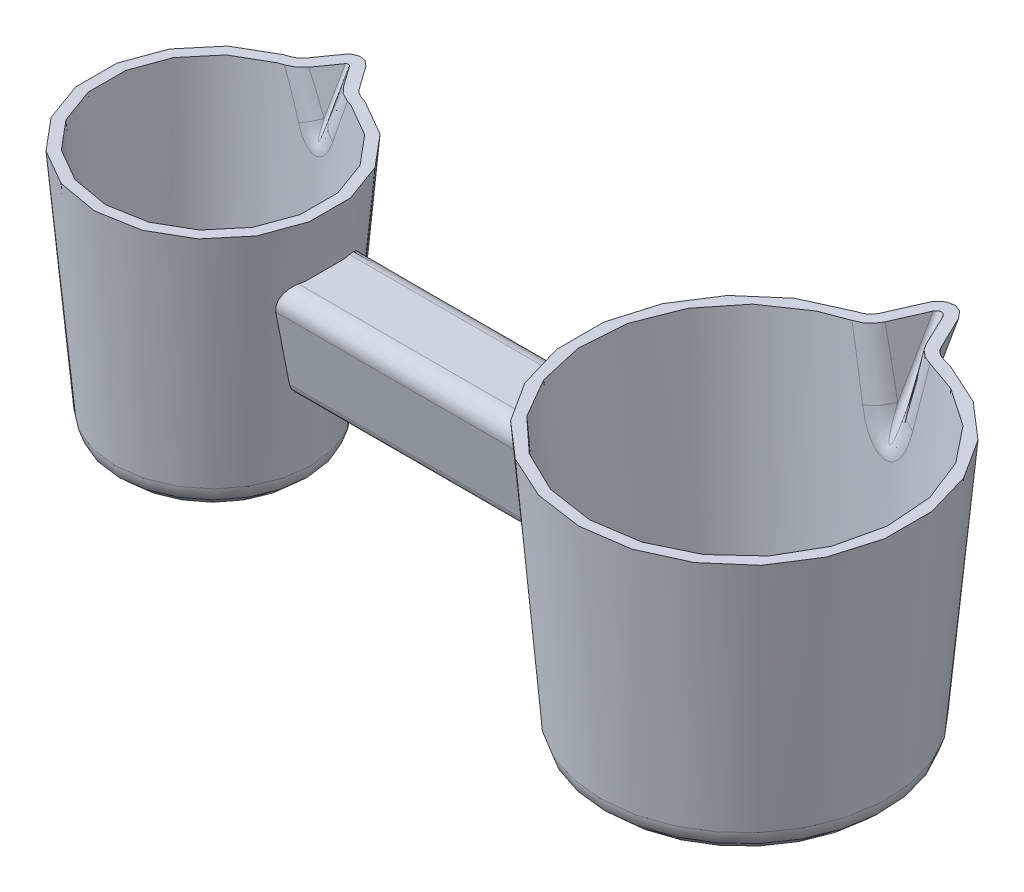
SolidWorks part; units mm, degrees
ref_plane "Front" through (0, 0, 0) normal (0, 0, 1) x (1, 0, 0)
ref_plane "Top" through (0, 0, 0) normal (0, 1, 0) x (1, 0, 0)
ref_plane "Right" through (0, 0, 0) normal (1, 0, 0) x (0, 0, -1)
sketch "Sketch2" plane through (0, 0, 0) normal (0, 1, 0) x (1, 0, 0)
  circle A0 centre (-60.7304, 0) radius 17.7145
extrude "Extrude1" add sketch "Sketch2" along normal blind 47 draft 5
sketch "Sketch3" plane through (0, 0, 0) normal (0, 1, 0) x (1, 0, 0)
  circle A0 centre (37.0756, 0) radius 26.1266
extrude "Extrude2" add sketch "Sketch3" along normal blind 50 draft 5
fillet "Fillet1" radius 5 1 edges at (-60.7304, 0, 17.7145)
fillet "Fillet2" radius 5 1 edges at (37.0756, 0, 26.1266)
sketch "Sketch5" plane through (0, 50, 0) normal (0, 1, 0) x (-1, 0, 0)
  line L0 (-37.0756, 0) -> (60.7304, 0) construction
ref_plane "Plane1" through (0, 37.5, -21.6506) normal (0, 0.866, -0.5) x (-1, 0, 0)
sketch "Sketch6" plane through (0, 37.5, -21.6506) normal (0, 0.866, -0.5) x (-1, 0, 0)
  line L0 (-47.3646, 7.653) -> (-36.2106, -12.4863)
  line L1 (-36.2106, -12.4863) -> (-25.986, 7.653)
  line L2 (-47.3646, 7.653) -> (-25.986, 7.653)
  line L3 (-36.2106, -12.4863) -> (-36.6753, 7.653) construction
extrude "Extrude5" add sketch "Sketch6" along normal up to surface and the other way up to surface
fillet "Fillet5" radius 3 3 edges at (36.2106, 36.9375, -35.7438)
sketch "Sketch8" plane through (0, 37.5, -21.6506) normal (0, 0.866, -0.5) x (-1, 0, 0)
  line L0 (51.1463, 10.1442) -> (60.7304, -1.5655)
  line L1 (60.7304, -1.5655) -> (70.3145, 10.1442)
  line L2 (51.1463, 10.1442) -> (70.3145, 10.1442)
  line L3 (60.7304, -1.5655) -> (60.7304, 10.1442) construction
extrude "Extrude6" add sketch "Sketch8" along normal up to surface and the other way up to surface
fillet "Fillet6" radius 2.5 3 edges at (-60.7304, 39.7361, -24.7493)
sketch "Sketch4" plane through (0, 0, 0) normal (1, 0, 0) x (0, 0, -1)
  line L0 (0, 21.5542) -> (0, 37.0006) construction
  line L1 (0, 27.5) -> (0, -27.5) construction
  line L2 (-8.4047, 37.0006) -> (8.4047, 37.0006)
  line L3 (8.4047, 37.0006) -> (4.3159, 17.9197)
  line L4 (-8.4047, 37.0006) -> (-4.3159, 17.9197)
  line L5 (4.3159, 17.9197) -> (-4.3159, 17.9197)
shell "Shell1" thickness 2
shell "Shell2" thickness 2
extrude "Extrude8" add sketch "Sketch4" against normal up to body and the other way up to body separate body
fillet "Fillet7" radius 3 4 edges at (-16.1089, 17.9197, 4.3159) (-16.1089, 17.9197, -4.3159) (-16.299, 37.0006, 8.4047) (-16.299, 37.0006, -8.4047)
